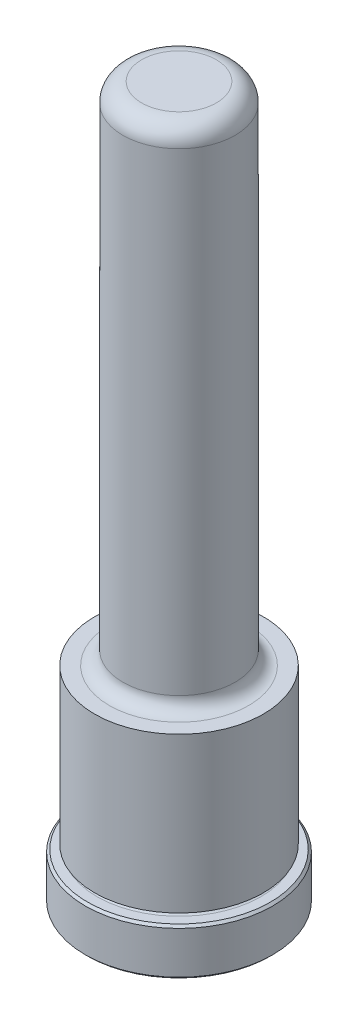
SolidWorks part; units mm, degrees
ref_plane "Front Plane" through (0, 0, 0) normal (0, 0, 1) x (1, 0, 0)
ref_plane "Top Plane" through (0, 0, 0) normal (0, 1, 0) x (1, 0, 0)
ref_plane "Right Plane" through (0, 0, 0) normal (1, 0, 0) x (0, 0, -1)
sketch "Sketch1" plane through (0, 0, 0) normal (1, 0, 0) x (0, 0, -1)
  line L0 (0, 0) -> (15.875, 0)
  line L1 (15.875, 0) -> (15.875, 7.9248)
  line L2 (15.875, 7.9248) -> (13.8938, 7.9248)
  line L3 (13.5128, 2.6782) -> (13.5128, 5.9795) construction
  line L4 (13.8938, 8.6868) -> (14.3002, 8.6868)
  line L5 (14.3002, 8.6868) -> (14.3002, 34.925)
  line L6 (14.3002, 34.925) -> (11.7983, 34.925)
  line L7 (9.5123, 37.211) -> (9.5123, 120.65)
  line L9 (9.5123, 120.65) -> (0, 120.65)
  line L10 (0, 120.65) -> (0, 0)
  line L11 (0, 0) -> (0, -7.2694) construction
  arc A0 (13.8938, 8.6868) -> (13.8938, 7.9248) centre (13.8938, 8.3058) ccw
  arc A1 (11.7983, 34.925) -> (9.5123, 37.211) centre (11.7983, 37.211) cw
  point P2 (9.5123, 120.65)
  point P14 (9.5123, 120.5512)
  point P19 (9.5123, 34.925)
  dimension "D14" = 0.762
  dimension "D8" = 2.286
  dimension "T" = 7.9248
  dimension "D2" = 0.762
  dimension "M" = 31.75
  dimension "B" = 28.6004
  dimension "L" = 120.65
  dimension "D7" = 0.7874
  dimension "A" = 34.925
  dimension "D" = 19.0246
  dimension "D15" = 85.725
revolve "Revolve1" add sketch "Sketch1" angle 360 about L11
chamfer "Chamfer1" distance 0.381 angle 45 2 edges at (0, 0, 15.875) (0, 7.9248, 15.875)
fillet "Fillet1" radius 3.175 1 edges at (0, 120.65, 9.5123)
